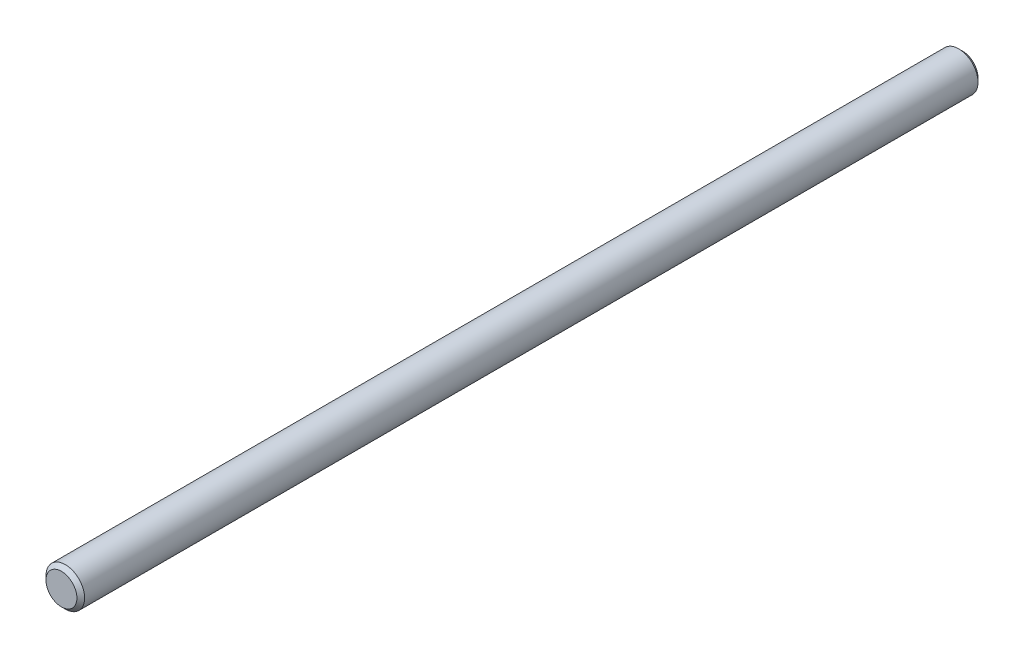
SolidWorks part; units mm, degrees
ref_plane "Plan de face" through (0, 0, 0) normal (0, 0, 1) x (1, 0, 0)
ref_plane "Plan de dessus" through (0, 0, 0) normal (0, 1, 0) x (1, 0, 0)
ref_plane "Plan de droite" through (0, 0, 0) normal (1, 0, 0) x (0, 0, -1)
sketch "Esquisse1" plane through (0, 0, 0) normal (0, 0, 1) x (1, 0, 0)
  circle A0 centre (0, 0) radius 1.5
extrude "Extrusion1" add sketch "Esquisse1" along normal blind 70
chamfer "Chanfrein1" distance 0.3 angle 45 2 edges at (1.5, 0, 0) (1.5, 0, 70)
